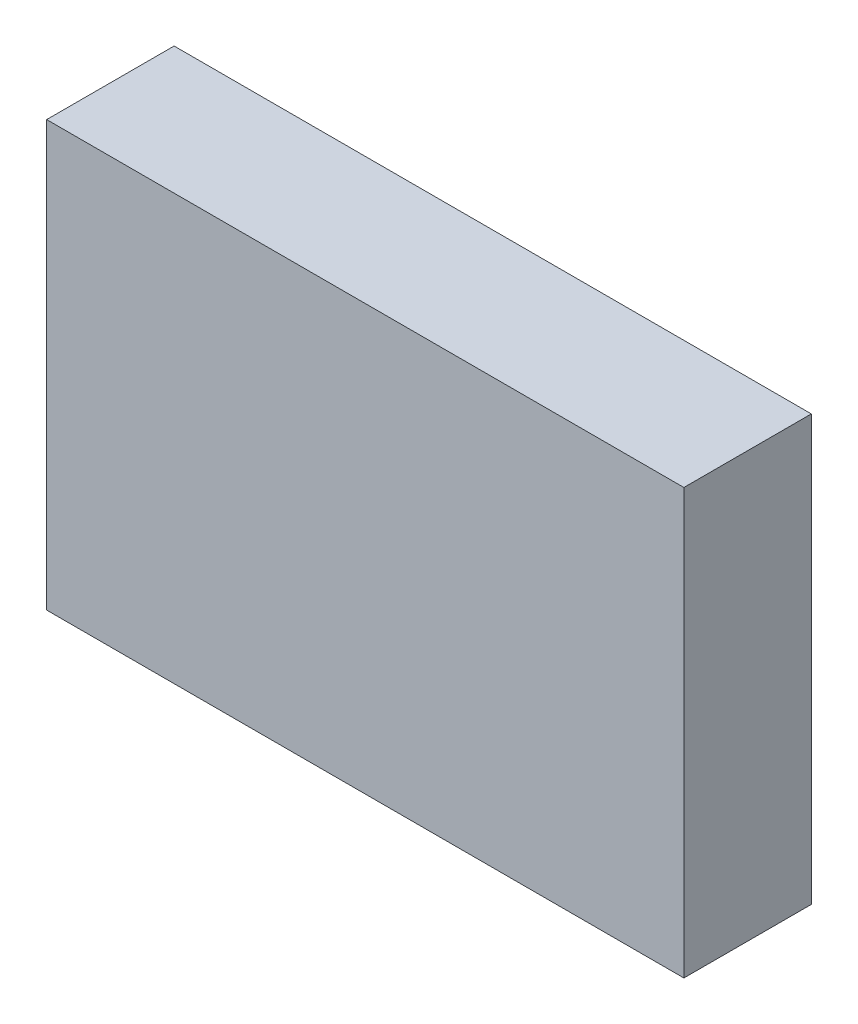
SolidWorks part; units mm, degrees
ref_plane "Ebene oben" through (0, 0, 0) normal (0, 0, 1) x (1, 0, 0)
ref_plane "Ebene vorne" through (0, 0, 0) normal (0, 1, 0) x (1, 0, 0)
ref_plane "Ebene rechts" through (0, 0, 0) normal (1, 0, 0) x (0, 0, -1)
sketch "Skizze1" plane through (0, 0, 0) normal (0, 1, 0) x (1, 0, 0)
  line L1 (37.5, -7.5) -> (-37.5, -7.5)
  line L2 (37.5, -7.5) -> (37.5, 7.5)
  line L3 (37.5, 7.5) -> (-37.5, 7.5)
  line L4 (-37.5, -7.5) -> (-37.5, 7.5)
  line L5 (37.5, -7.5) -> (-37.5, 7.5) construction
  line L6 (37.5, 7.5) -> (-37.5, -7.5) construction
  point P0 (0, 0)
  dimension "D1" = 75
  dimension "D2" = 15
extrude "Aufsatz-Linear austragen1" add sketch "Skizze1" along normal blind 50
